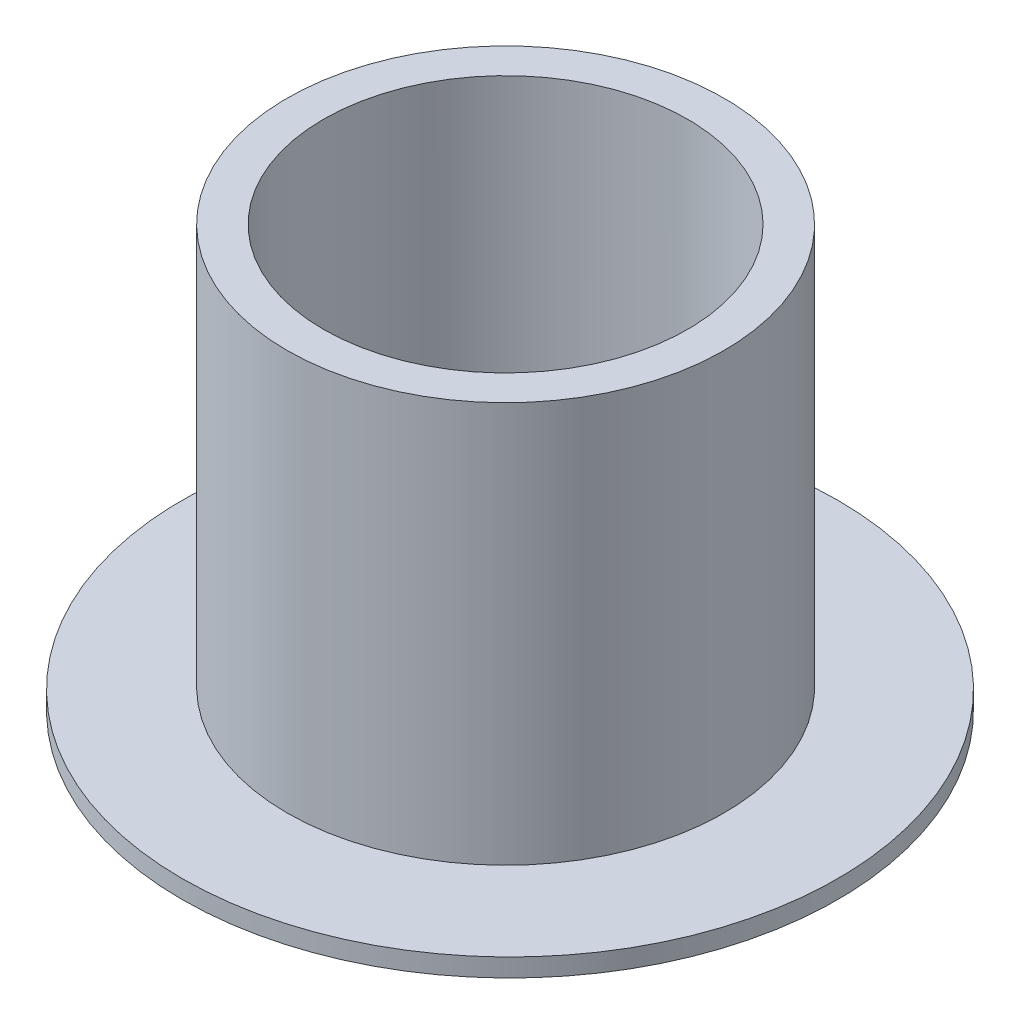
SolidWorks part; units mm, degrees
ref_plane "Front Plane" through (0, 0, 0) normal (0, 0, 1) x (1, 0, 0)
ref_plane "Top Plane" through (0, 0, 0) normal (0, 1, 0) x (1, 0, 0)
ref_plane "Right Plane" through (0, 0, 0) normal (1, 0, 0) x (0, 0, -1)
sketch "Sketch1" plane through (0, 0, 0) normal (0, 1, 0) x (1, 0, 0)
  circle A0 centre (0, 0) radius 12.7
  circle A1 centre (0, 0) radius 15.24
  dimension "D1" = 30.48
  dimension "D2" = 25.4
extrude "Boss-Extrude1" add sketch "Sketch1" along normal blind 27.94
sketch "Sketch2" plane through (0, 0, 0) normal (0, -1, 0) x (1, 0, 0)
  circle A0 centre (0.3077, 0) radius 13.0077
  circle A1 centre (0.3077, 0) radius 22.86
  dimension "D1" = 45.72
extrude "Boss-Extrude2" add sketch "Sketch2" along normal blind 1.27
